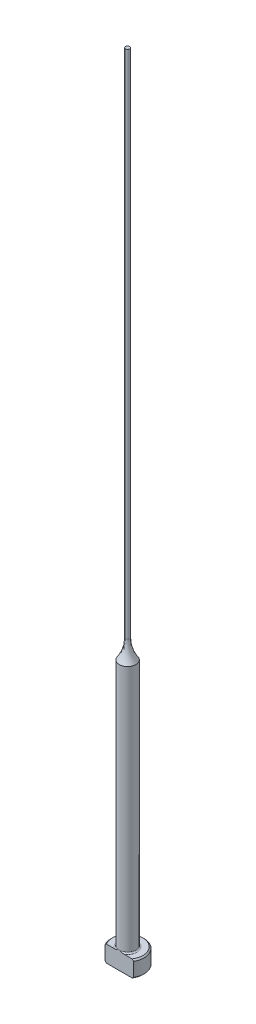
SolidWorks part; units mm, degrees
ref_plane "Front Plane" through (0, 0, 0) normal (0, 0, 1) x (1, 0, 0)
ref_plane "Top Plane" through (0, 0, 0) normal (0, 1, 0) x (1, 0, 0)
ref_plane "Right Plane" through (0, 0, 0) normal (1, 0, 0) x (0, 0, -1)
sketch "Sketch1" plane through (0, 0, 0) normal (0, 0, 1) x (1, 0, 0)
  line L0 (0, 259.9588) -> (0, -15.1925) construction
  line L1 (0, 0) -> (-3.175, 0)
  line L2 (-3.175, 0) -> (-3.175, 3.175)
  line L3 (-3.175, 3.175) -> (-1.5875, 3.175)
  line L4 (-0.3962, 54.5027) -> (-0.3962, 152.4)
  line L5 (-0.3962, 152.4) -> (0, 152.4)
  line L6 (0, 152.4) -> (0, 0)
  line L7 (-1.5875, 3.175) -> (-1.5875, 50.8)
  arc A0 (-1.5875, 50.8) -> (-0.3962, 54.5027) centre (-6.7462, 54.5027) ccw
  point P13 (-1.5875, 0)
  dimension "D1" = 6.35
  dimension "L" = 152.4
  dimension "D2" = 3.175
  dimension "H" = 6.35
  dimension "T" = 3.175
  dimension "D" = 0.7925
  dimension "S" = 50.8
revolve "Revolve1" add sketch "Sketch1" angle 360 about L0
chamfer "Chamfer1" distance 0.254 angle 45 2 edges at (0, 3.175, 3.175) (0, 0, 3.175)
fillet "Fillet1" radius 0.254 1 edges at (0, 3.175, 1.5875)
sketch "Sketch2" plane through (0, 0, 0) normal (0, -1, 0) x (1, 0, 0)
  line L0 (-2.7496, 1.5875) -> (2.7496, 1.5875)
  arc A0 (2.7496, 1.5875) -> (-2.7496, 1.5875) centre (0, 0) ccw
  circle A1 centre (0, 0) radius 3.175 construction
  circle A2 centre (0, 0) radius 1.5875 construction
extrude "Cut-Extrude1" cut sketch "Sketch2" against normal through all
